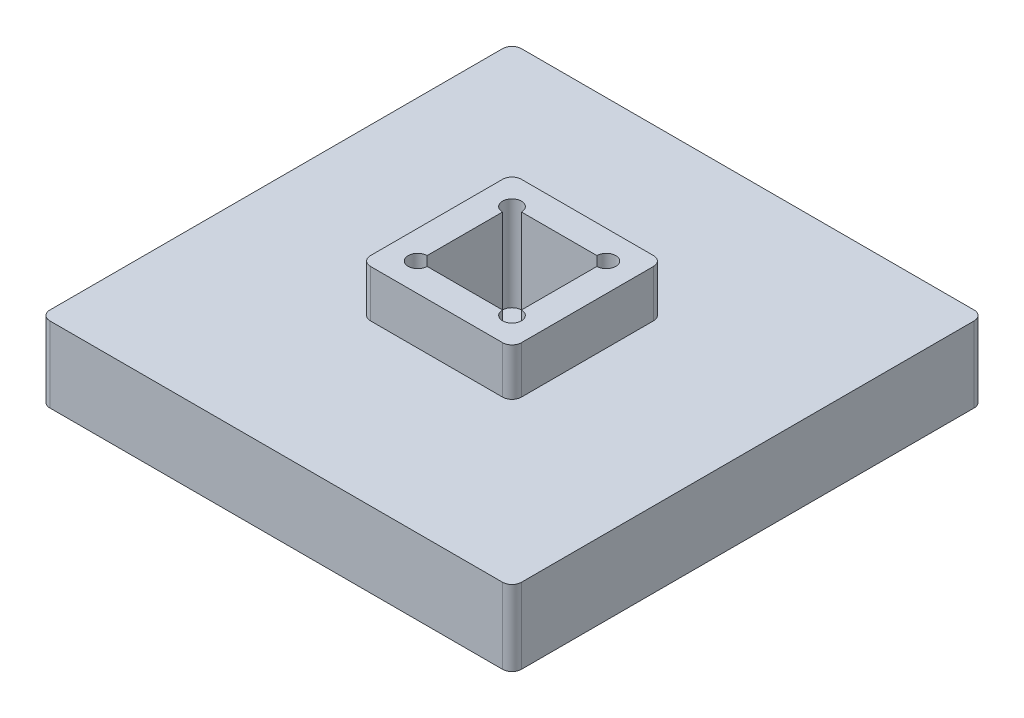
SolidWorks part; units mm, degrees
ref_plane "Front" through (0, 0, 0) normal (0, 0, 1) x (1, 0, 0)
ref_plane "Top" through (0, 0, 0) normal (0, 1, 0) x (1, 0, 0)
ref_plane "Right" through (0, 0, 0) normal (1, 0, 0) x (0, 0, -1)
sketch "草图1" plane through (0, 0, 0) normal (0, 1, 0) x (1, 0, 0)
  line L1 (-25, -25) -> (25, -25)
  line L2 (-25, -25) -> (-25, 25)
  line L3 (-25, 25) -> (25, 25)
  line L4 (25, -25) -> (25, 25)
  line L5 (-25, -25) -> (25, 25) construction
  line L6 (-25, 25) -> (25, -25) construction
  point P0 (0, 0)
  dimension "D1" = 50
  dimension "D2" = 50
extrude "凸台-拉伸1" add sketch "草图1" along normal blind 8
sketch "草图2" plane through (0, 8, 0) normal (0, 1, 0) x (1, 0, 0)
  line L1 (-5, -5) -> (5, -5)
  line L2 (-5, -5) -> (-5, 5)
  line L3 (-5, 5) -> (5, 5)
  line L4 (5, -5) -> (5, 5)
  line L5 (-5, -5) -> (5, 5) construction
  line L6 (-5, 5) -> (5, -5) construction
  line L7 (-8, -8) -> (8, -8)
  line L8 (-8, -8) -> (-8, 8)
  line L9 (-8, 8) -> (8, 8)
  line L10 (8, -8) -> (8, 8)
  line L11 (-8, -8) -> (8, 8) construction
  line L12 (-8, 8) -> (8, -8) construction
  circle A0 centre (-5, 5) radius 1
  circle A1 centre (5, 5) radius 1
  circle A2 centre (5, -5) radius 1
  circle A3 centre (-5, -5) radius 1
  point P0 (0, 0)
  point P5 (0, 0)
  dimension "D5" = 2
  dimension "D6" = 2
  dimension "D7" = 2
  dimension "D8" = 2
  dimension "D1" = 10
  dimension "D2" = 10
  dimension "D3" = 3
  dimension "D4" = 3
extrude "凸台-拉伸2" add sketch "草图2" along normal blind 5 contours L7 L10 L9 L8 A3 L2 A0 L3 A1 L4 A2 L1
fillet "圆角1" radius 1 8 edges at (8, 10.5, 8) (8, 10.5, -8) (-8, 10.5, -8) (-8, 10.5, 8) (-25, 4, -25) (-25, 4, 25) (25, 4, 25) (25, 4, -25)
sketch "草图3" plane through (0, 8, 0) normal (0, 1, 0) x (1, 0, 0)
  line L4 (-5, 4) -> (-5, -4)
  line L5 (-4, -5) -> (4, -5)
  line L6 (5, -4) -> (5, 4)
  line L7 (4, 5) -> (-4, 5)
  line L8 (-5, 4) -> (-5, -4)
  line L9 (-4, -5) -> (4, -5)
  line L10 (5, -4) -> (5, 4)
  line L11 (4, 5) -> (-4, 5)
  arc A4 (-5, -4) -> (-4, -5) centre (-5, -5) ccw
  arc A5 (4, -5) -> (5, -4) centre (5, -5) ccw
  arc A6 (5, 4) -> (4, 5) centre (5, 5) ccw
  arc A7 (-4, 5) -> (-5, 4) centre (-5, 5) ccw
  arc A8 (-5, -4) -> (-4, -5) centre (-5, -5) ccw
  arc A9 (4, -5) -> (5, -4) centre (5, -5) ccw
  arc A10 (5, 4) -> (4, 5) centre (5, 5) ccw
  arc A11 (-4, 5) -> (-5, 4) centre (-5, 5) ccw
  dimension "D1" = 0
extrude "切除-拉伸1" cut sketch "草图3" against normal blind 5
